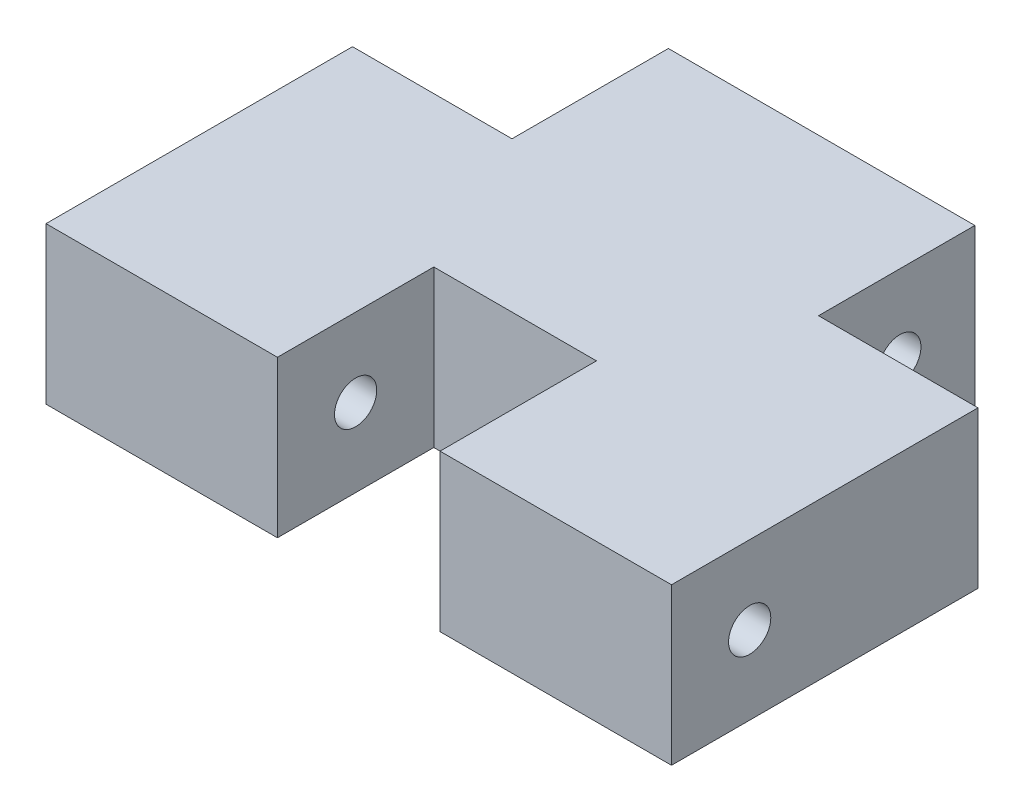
SolidWorks part; units mm, degrees
ref_plane "Front Plane" through (0, 0, 0) normal (0, 0, 1) x (1, 0, 0)
ref_plane "Top Plane" through (0, 0, 0) normal (0, 1, 0) x (1, 0, 0)
ref_plane "Right Plane" through (0, 0, 0) normal (1, 0, 0) x (0, 0, -1)
sketch "Sketch1" plane through (0, 0, 0) normal (0, 1, 0) x (1, 0, 0)
  line L0 (-6.223, 6.223) -> (6.223, 6.223)
  line L1 (6.223, 6.223) -> (6.223, -0.127)
  line L2 (6.223, -0.127) -> (12.7, -0.127)
  line L3 (12.7, -0.127) -> (12.7, -12.573)
  line L4 (12.7, -12.573) -> (3.302, -12.573)
  line L5 (3.302, -12.573) -> (3.302, -6.223)
  line L6 (3.302, -6.223) -> (-3.302, -6.223)
  line L7 (-3.302, -6.223) -> (-3.302, -12.573)
  line L8 (-3.302, -12.573) -> (-12.7, -12.573)
  line L9 (-12.7, -12.573) -> (-12.7, -0.127)
  line L10 (-12.7, -0.127) -> (-6.223, -0.127)
  line L11 (-6.223, -0.127) -> (-6.223, 6.223)
  dimension "D1" = 12.446
  dimension "D2" = 6.35
  dimension "D3" = 12.446
  dimension "D4" = 9.398
  dimension "D5" = 6.35
  dimension "D6" = 6.604
  dimension "D7" = 6.477
  dimension "D8" = 6.223
  dimension "D9" = 6.223
extrude "FingerBase" add sketch "Sketch1" along normal blind 6.35
sketch "Sketch2" plane through (12.7, 0, 0) normal (1, 0, 0) x (0, 0, -1)
  line L0 (-12.573, 6.35) -> (-0.127, 6.35) construction
  line L1 (-12.573, 6.35) -> (-12.573, 0) construction
  line L2 (-0.127, 6.35) -> (6.223, 6.35) construction
  line L3 (6.223, 6.35) -> (6.223, 0) construction
  circle A0 centre (-9.398, 3.175) radius 0.8572
  circle A1 centre (3.175, 3.175) radius 0.8573
  dimension "D1" = 1.7145
  dimension "D2" = 3.175
  dimension "D3" = 3.175
  dimension "D4" = 3.175
  dimension "D5" = 3.048
extrude "PinHoles" cut sketch "Sketch2" against normal through all both and the other way through all
